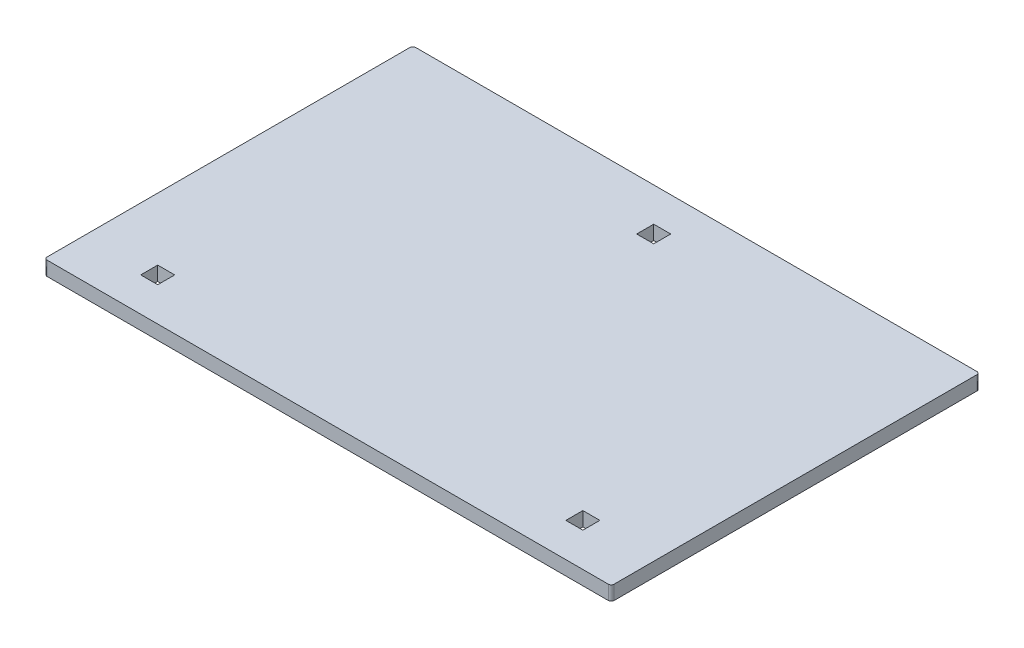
SolidWorks part; units mm, degrees
ref_plane "Front Plane" through (0, 0, 0) normal (0, 0, 1) x (1, 0, 0)
ref_plane "Top Plane" through (0, 0, 0) normal (0, 1, 0) x (1, 0, 0)
ref_plane "Right Plane" through (0, 0, 0) normal (1, 0, 0) x (0, 0, -1)
sketch "Sketch1" plane through (0, 0, 0) normal (0, 1, 0) x (1, 0, 0)
  line L0 (97.45, -130) -> (102.55, -130)
  line L1 (0, 0) -> (200, 0)
  line L2 (0, 0) -> (0, -130)
  line L3 (0, -130) -> (97.45, -130)
  line L4 (200, 0) -> (200, -130)
  line L6 (100, -12) -> (103, -12)
  line L7 (22, -112) -> (28, -112)
  line L8 (100, -18) -> (103, -18)
  line L9 (103, -12) -> (103, -18)
  line L10 (102.55, -130) -> (200, -130)
  line L11 (100, -12) -> (97, -12)
  line L12 (22, -112) -> (22, -118)
  line L13 (100, -18) -> (97, -18)
  line L14 (97, -12) -> (97, -18)
  line L15 (22, -118) -> (28, -118)
  line L16 (28, -112) -> (28, -118)
  line L17 (172, -112) -> (178, -112)
  line L18 (172, -112) -> (172, -118)
  line L19 (172, -118) -> (178, -118)
  line L20 (178, -112) -> (178, -118)
  circle A3 centre (25, -115) radius 3 construction
  circle A4 centre (175, -115) radius 3 construction
  dimension "D3" = 6
  dimension "D4" = 6
  dimension "D5" = 6
  dimension "D11" = 6
  dimension "D12" = 15
  dimension "D13" = 25
  dimension "D1" = 200
  dimension "D2" = 130
  dimension "D6" = 6
extrude "Boss-Extrude1" add sketch "Sketch1" along normal blind 5
fillet "Fillet1" radius 1 4 edges at (0, 2.5, 0) (0, 2.5, 130) (200, 2.5, 0) (200, 2.5, 130)
